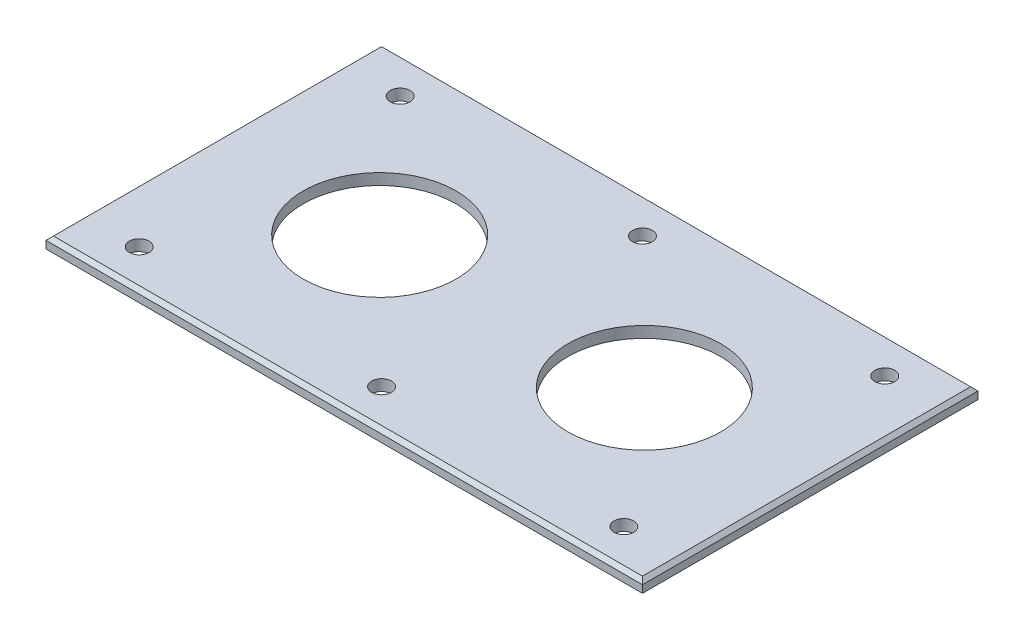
SolidWorks part; units mm, degrees
ref_plane "Front Plane" through (0, 0, 0) normal (0, 0, 1) x (1, 0, 0)
ref_plane "Top Plane" through (0, 0, 0) normal (0, 1, 0) x (1, 0, 0)
ref_plane "Right Plane" through (0, 0, 0) normal (1, 0, 0) x (0, 0, -1)
sketch "Sketch1" plane through (0, 0, 0) normal (0, 1, 0) x (1, 0, 0)
  line L0 (-160, 45) -> (0, 45) construction
  line L1 (0, 0) -> (-160, 0)
  line L2 (0, 0) -> (0, 90)
  line L3 (0, 90) -> (-160, 90)
  line L4 (-160, 0) -> (-160, 90)
  line L5 (-80, 90) -> (-80, 0) construction
  circle A0 centre (-115.5, 45) radius 23.6
  circle A1 centre (-44.5, 45) radius 23.6
  dimension "D3" = 47.2
  dimension "D4" = 71
  dimension "D1" = 90
  dimension "D2" = 160
  dimension "D5" = 35.5
extrude "Boss-Extrude1" add sketch "Sketch1" along normal blind 14
sketch "Sketch2" plane through (0, 14, 0) normal (0, 1, 0) x (1, 0, 0)
  line L1 (-160, 90) -> (0, 90)
  line L2 (-160, 90) -> (-160, 0)
  line L3 (-160, 0) -> (0, 0)
  line L4 (0, 90) -> (0, 0)
  circle A0 centre (-115.5, 45) radius 20.5
  circle A1 centre (-44.5, 45) radius 20.5
  dimension "D1" = 41
extrude "Boss-Extrude2" add sketch "Sketch2" along normal blind 2
sketch "Sketch3" plane through (-160, 0, 0) normal (-1, 0, 0) x (0, 0, 1)
  line L0 (-90, 8) -> (0, 8) construction
  line L1 (-90, 16) -> (-90, 0) construction
  line L2 (0, 16) -> (0, 0) construction
  circle A0 centre (-70, 8) radius 3.65
  circle A1 centre (-20, 8) radius 3.65
  dimension "D1" = 7.3
  dimension "D2" = 20
  dimension "D3" = 20
extrude "Cut-Extrude1" cut sketch "Sketch3" against normal blind 20
sketch "Sketch4" plane through (0, 0, 0) normal (1, 0, 0) x (0, 0, -1)
  circle A0 centre (20, 8) radius 3.65
  circle A1 centre (70, 8) radius 3.65
extrude "Cut-Extrude2" cut sketch "Sketch4" against normal blind 20
chamfer "Chamfer1" distance 1 angle 45 4 edges at (0, 8, -23.65) (0, 8, -73.65) (-160, 8, -16.35) (-160, 8, -66.35)
sketch "Sketch5" plane through (0, 0, 0) normal (0, -1, 0) x (1, 0, 0)
  line L0 (-80, 0) -> (-80, -90) construction
  line L1 (-160, 0) -> (0, 0) construction
  line L2 (0, -90) -> (-160, -90) construction
  line L3 (-145, 0) -> (-145, -90) construction
  line L4 (-15, 0) -> (-15, -90) construction
  line L5 (-160, -90) -> (-160, 0) construction
  line L6 (0, 0) -> (0, -90) construction
  line L7 (-160, -45) -> (0, -45) construction
  circle A0 centre (-145, -10) radius 2.15
  circle A1 centre (-80, -10) radius 2.15
  circle A2 centre (-15, -10) radius 2.15
  circle A3 centre (-15, -80) radius 2.15
  circle A4 centre (-80, -80) radius 2.15
  circle A5 centre (-145, -80) radius 2.15
  dimension "D3" = 4.3
  dimension "D4" = 10
  dimension "D1" = 15
  dimension "D2" = 15
extrude "Cut-Extrude3" cut sketch "Sketch5" against normal through all
sketch "Sketch6" plane through (0, 0, 0) normal (0, -1, 0) x (1, 0, 0)
  line L0 (0, 0) -> (0, -90) construction
  line L1 (-160, 0) -> (0, 0) construction
  line L2 (-80, 0) -> (-80, -90) construction
  line L3 (0, -90) -> (-160, -90) construction
  circle A0 centre (0, -2) radius 4
  circle A1 centre (-160, -2) radius 4
  dimension "D1" = 8
  dimension "D2" = 2
extrude "Cut-Extrude4" cut sketch "Sketch6" against normal blind 10
sketch "Sketch7" plane through (0, 0, 0) normal (1, 0, 0) x (0, 0, -1)
  line L0 (90, 16) -> (90, 0) construction
  line L1 (0, 0) -> (90, 0)
  line L2 (0, 0) -> (0, 13)
  line L3 (0, 13) -> (90, 13)
  line L4 (90, 0) -> (90, 13)
  line L5 (0, 16) -> (90, 16) construction
  dimension "D1" = 3
extrude "Cut-Extrude5" cut sketch "Sketch7" against normal through all
sketch "Sketch8" plane through (0, 13, 0) normal (0, -1, 0) x (1, 0, 0)
  circle A0 centre (-115.5, -45) radius 20.5
  circle A1 centre (-115.5, -45) radius 30.2294
  circle A2 centre (-44.5, -45) radius 20.5
  circle A3 centre (-44.5, -45) radius 35.6894
  circle A4 centre (-115.5, -45) radius 20.5 construction
  dimension "D1" = 41
extrude "Boss-Extrude3" add sketch "Sketch8" against normal blind 2
sketch "Sketch9" plane through (0, 16, 0) normal (0, 1, 0) x (1, 0, 0)
  line L0 (-160, 45) -> (-136, 45) construction
  line L1 (-160, 90) -> (-160, 0) construction
  circle A0 centre (-145, 80) radius 2.65
  circle A1 centre (-80, 80) radius 2.65
  circle A2 centre (-15, 80) radius 2.65
  circle A3 centre (-115.5, 45) radius 20.5 construction
  circle A4 centre (-15, 10) radius 2.65
  circle A5 centre (-80, 10) radius 2.65
  circle A6 centre (-145, 10) radius 2.65
  dimension "D1" = 5.3
extrude "Cut-Extrude6" cut sketch "Sketch9" against normal blind 11
chamfer "Chamfer2" distance 1 angle 45 4 edges at (-160, 16, -45) (-80, 16, -90) (0, 16, -45) (-80, 16, 0)
